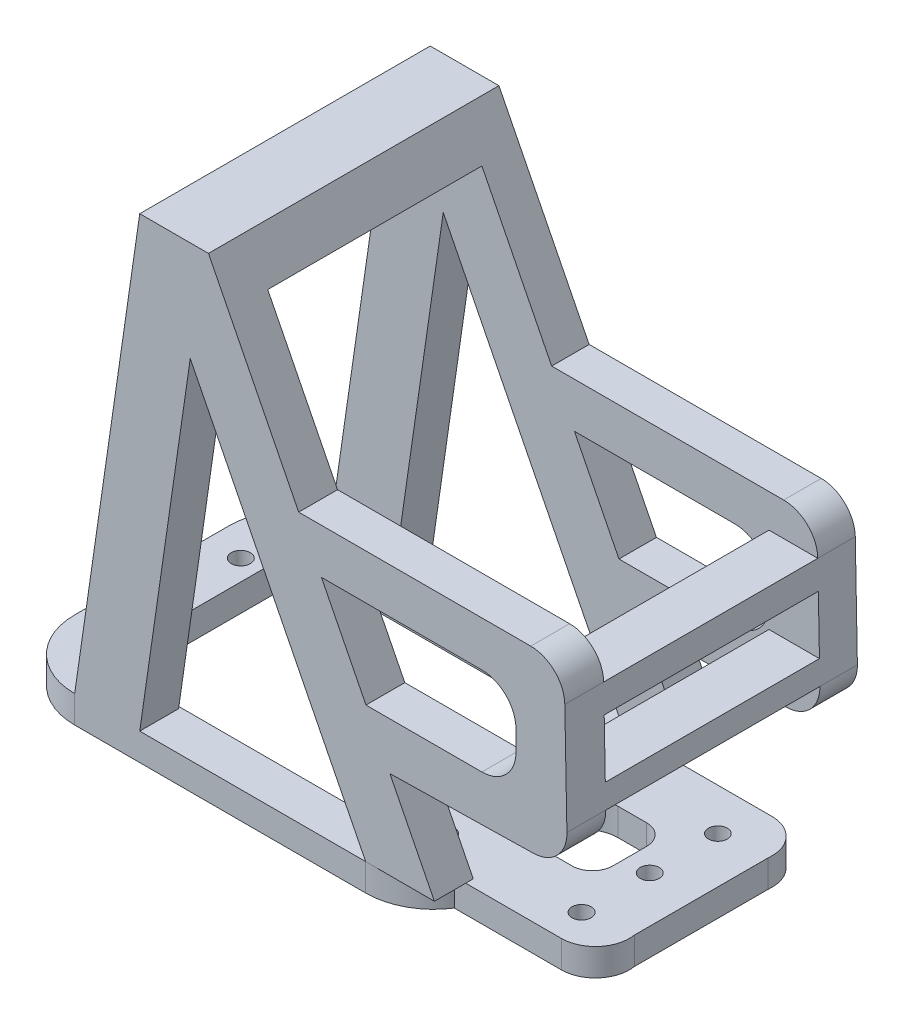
SolidWorks part; units mm, degrees
ref_plane "前视基准面" through (0, 0, 0) normal (0, 0, 1) x (1, 0, 0)
ref_plane "上视基准面" through (0, 0, 0) normal (0, 1, 0) x (1, 0, 0)
ref_plane "右视基准面" through (0, 0, 0) normal (1, 0, 0) x (0, 0, -1)
sketch "草图1" plane through (0, 0, 0) normal (0, 1, 0) x (1, 0, 0)
  line L0 (61.0864, -14.9277) -> (61.0864, -17.1775) construction
  line L1 (-10.3707, 21.899) -> (31.6683, 21.899)
  line L2 (-20.3707, 11.899) -> (-20.3707, -10.7205)
  line L3 (-10.3707, -20.7205) -> (32.3279, -20.7205)
  line L5 (41.2303, 14.8263) -> (56.4092, 14.8263)
  line L7 (40.7399, -16.1276) -> (56.4399, -16.1276)
  line L10 (-7.3707, 15.899) -> (23.8662, 15.899)
  line L11 (-12.3707, 10.899) -> (-12.3707, -9.7205)
  line L12 (-7.3707, -14.7205) -> (23.8662, -14.7205)
  line L14 (43.8001, 4.8263) -> (48.008, 4.8263)
  line L16 (43.828, -6.1276) -> (48.008, -6.1276)
  line L17 (51.008, 1.8263) -> (51.008, -3.1276)
  line L21 (61.3782, 9.2709) -> (61.3782, -10.3446)
  line L22 (28.8662, -9.7205) -> (28.8662, 10.899)
  line L24 (38.8022, -0.3196) -> (38.8301, -1.2735)
  arc A0 (-20.3707, -10.7205) -> (-10.3707, -20.7205) centre (-10.3707, -10.7205) ccw
  arc A1 (-10.3707, 21.899) -> (-20.3707, 11.899) centre (-10.3707, 11.899) ccw
  arc A2 (32.3279, -20.7205) -> (40.7399, -16.1276) centre (32.3279, -10.7205) ccw
  arc A3 (31.6683, 21.899) -> (41.2303, 14.8263) centre (31.6683, 11.899) cw
  arc A4 (61.3782, -10.3446) -> (56.4399, -16.1276) centre (56.4399, -11.1276) cw
  arc A5 (61.3782, 9.2709) -> (56.4092, 14.8263) centre (56.4092, 9.8263) ccw
  arc A6 (52.508, -7.6275) -> (49.5081, -7.6275) centre (51.008, -7.6275) ccw construction
  arc A9 (-7.3707, -14.7205) -> (-12.3707, -9.7205) centre (-7.3707, -9.7205) cw
  arc A10 (-7.3707, 15.899) -> (-12.3707, 10.899) centre (-7.3707, 10.899) ccw
  arc A13 (51.008, -3.1276) -> (48.008, -6.1276) centre (48.008, -3.1276) cw
  arc A14 (51.008, 1.8263) -> (48.008, 4.8263) centre (48.008, 1.8263) ccw
  circle A15 centre (-15.392, 8.6725) radius 1.4
  circle A16 centre (-15.392, -1.3275) radius 1.3979
  circle A17 centre (-15.392, -11.3275) radius 1.3827
  circle A18 centre (34.608, 8.6725) radius 1.3886
  circle A19 centre (34.608, -11.3275) radius 1.3911
  circle A20 centre (54.608, 8.6725) radius 1.388
  circle A21 centre (54.608, -1.3275) radius 1.397
  circle A22 centre (54.608, -11.3275) radius 1.4035
  arc A23 (38.8301, -1.2735) -> (43.828, -6.1276) centre (43.828, -1.1276) ccw
  arc A24 (38.8022, -0.3196) -> (43.8001, 4.8263) centre (43.8001, -0.1737) cw
  arc A25 (28.8662, -9.7205) -> (23.8662, -14.7205) centre (23.8662, -9.7205) cw
  arc A26 (28.8662, 10.899) -> (23.8662, 15.899) centre (23.8662, 10.899) ccw
  point P6 (28.5114, 15.899)
  point P21 (61.0864, -15.3365)
  point P46 (51.008, -6.1276)
  dimension "D1" = 10
  dimension "D2" = 5
  dimension "D3" = 10
  dimension "D4" = 5
  dimension "D5" = 10
  dimension "D6" = 3
  dimension "D7" = 2.8
  dimension "D11" = 5
  dimension "D8" = 6
  dimension "D9" = 6
  dimension "D10" = 8
extrude "凸台-拉伸1" add sketch "草图1" along normal blind 4
sketch "草图5" plane through (0, 0, 20.7205) normal (0, 0, 1) x (1, 0, 0)
  line L0 (-10.3707, 4) -> (-0.8249, 69.7495)
  line L3 (-10.3707, 4) -> (32.3279, 4) construction
  line L4 (-0.8249, 4) -> (-10.3707, 4)
  line L5 (32.3279, 4) -> (-0.8249, 69.7495)
  line L6 (-0.8249, 69.7495) -> (9.2578, 69.7495)
  line L7 (9.2578, 69.7495) -> (42.4106, 4)
  line L8 (40.7399, 4) -> (56.4399, 4) construction
  line L9 (42.4106, 4) -> (32.3279, 4)
  line L10 (22.4989, 43.4893) -> (56.5462, 43.4893)
  line L11 (61.5453, 38.5847) -> (61.8529, 22.4558)
  line L12 (56.9492, 17.3614) -> (35.876, 16.9595)
  line L13 (25.8342, 36.8748) -> (49.3813, 36.8748)
  line L14 (54.3813, 31.8748) -> (54.3813, 28.9109)
  line L15 (49.3813, 23.9109) -> (32.3709, 23.9109)
  line L16 (-0.8249, 4) -> (6.5868, 55.0504)
  arc A0 (54.3813, 28.9109) -> (49.3813, 23.9109) centre (49.3813, 28.9109) cw
  arc A1 (54.3813, 31.8748) -> (49.3813, 36.8748) centre (49.3813, 31.8748) ccw
  arc A2 (61.8529, 22.4558) -> (56.9492, 17.3614) centre (56.8538, 22.3605) cw
  arc A3 (56.5462, 43.4893) -> (61.5453, 38.5847) centre (56.5462, 38.4893) cw
  spline S0 degree 3 poles (82.3635, 34.1138) (82.1108, 34.227) (81.7489, 34.3893) (81.1525, 34.6566) (80.4773, 34.9593) (79.7004, 35.3076) (78.6378, 35.784) (77.507, 36.2909) (75.9609, 36.9841) (74.8944, 37.4622) (74.111, 37.8135) (73.8509, 37.9301) (73.6209, 38.0332) (73.3899, 38.1367) (73.2086, 38.218) (72.967, 38.3263) (72.7294, 38.4329) (72.375, 38.5918) (71.8857, 38.8112) (71.3179, 39.0657) (70.476, 39.4432) (69.6786, 39.8007) (68.8034, 40.1931) (68.3054, 40.4163) (67.8294, 40.6297) (67.4241, 40.8115) (66.9507, 41.0237) (66.3775, 41.2807) (65.8152, 41.5329) (65.1974, 41.8099) (64.5957, 42.0796) (64.02, 42.3378) (63.4354, 42.5999) (63.0021, 42.7942) (62.5979, 42.9754) (62.2232, 43.1434) (61.7973, 43.3344) (61.4045, 43.5105) (61.0077, 43.6885) (60.665, 43.8421) (60.3546, 43.9813) (60.1352, 44.0797) (59.8921, 44.1887) (59.5959, 44.3215) (59.2631, 44.4707) (58.9915, 44.5925) (58.8406, 44.6602) (58.8096, 44.6741) knots 0 0 0 0 0.032193 0.04611 0.075984 0.118223 0.145085 0.21136 0.262286 0.342049 0.347223 0.362088 0.375183 0.37653 0.391497 0.398287 0.4073 0.421757 0.443444 0.469626 0.494074 0.550684 0.571193 0.605541 0.614113 0.631817 0.657156 0.674406 0.704819 0.728769 0.753084 0.781436 0.802085 0.827522 0.836612 0.853553 0.875226 0.890849 0.903564 0.92575 0.93448 0.943081 0.953685 0.965424 0.98079 0.996052 1 1 1 1 construction
  point P31 (61.4517, 43.4893)
  dimension "D1" = 5
extrude "凸台-拉伸2" add sketch "草图5" against normal blind 5.7
sketch "草图6" plane through (0, 0, -21.899) normal (0, 0, -1) x (-1, 0, 0)
  line L0 (10.3707, 4) -> (0.8249, 69.7495)
  line L2 (0.8249, 4) -> (-6.5868, 55.0504)
  line L3 (-6.5868, 55.0504) -> (-32.3279, 4)
  line L4 (-32.3279, 4) -> (-42.4106, 4)
  line L5 (-42.4106, 4) -> (-9.2578, 69.7495)
  line L6 (-9.2578, 69.7495) -> (0.8249, 69.7495)
  line L7 (-22.4989, 43.4893) -> (-56.5462, 43.4893)
  line L8 (-61.5453, 38.5847) -> (-61.8529, 22.4558)
  line L9 (-56.9492, 17.3614) -> (-35.876, 16.9595)
  line L10 (-35.876, 16.9595) -> (-32.3709, 23.9109)
  line L11 (-32.3709, 23.9109) -> (-49.3813, 23.9109)
  line L12 (-54.3813, 28.9109) -> (-54.3813, 31.8748)
  line L13 (-49.3813, 36.8748) -> (-25.8342, 36.8748)
  line L14 (-25.8342, 36.8748) -> (-22.4989, 43.4893)
  line L15 (0.8249, 4) -> (10.3707, 4)
  arc A0 (-49.3813, 23.9109) -> (-54.3813, 28.9109) centre (-49.3813, 28.9109) cw
  arc A1 (-49.3813, 36.8748) -> (-54.3813, 31.8748) centre (-49.3813, 31.8748) ccw
  arc A2 (-56.9492, 17.3614) -> (-61.8529, 22.4558) centre (-56.8538, 22.3605) cw
  arc A3 (-56.5462, 43.4893) -> (-61.5453, 38.5847) centre (-56.5462, 38.4893) ccw
  point P32 (-54.3813, 23.9109)
  point P35 (-54.3813, 36.8748)
  point P38 (-61.9483, 17.4568)
  point P41 (-61.4517, 43.4893)
  dimension "D1" = 5
extrude "凸台-拉伸4" add sketch "草图6" against normal blind 5.5 contours L6 L5 L4 L3 L2 L0 M23 | L7 A3 L8 A2 L9 L5 L11 A0 L12 A1 L13
sketch "草图7" plane through (0, 0, -16.399) normal (0, 0, 1) x (1, 0, 0)
  line L0 (-0.8249, 69.7495) -> (9.2578, 69.7495)
  line L1 (9.2578, 69.7495) -> (12.2568, 63.8017)
  line L2 (9.2578, 69.7495) -> (22.4989, 43.4893) construction
  line L3 (12.2568, 63.8017) -> (-1.6884, 63.8017)
  line L4 (-10.3707, 4) -> (-0.8249, 69.7495) construction
  line L5 (-1.6884, 63.8017) -> (-0.8249, 69.7495)
  line L6 (61.5453, 38.5847) -> (54.3813, 38.5847)
  line L7 (54.3813, 38.5847) -> (54.3813, 34.4335)
  line L8 (54.3813, 34.4335) -> (61.6245, 34.4335)
  line L9 (61.5453, 38.5847) -> (61.8529, 22.4558) construction
  line L10 (61.6245, 34.4335) -> (61.5453, 38.5847)
  line L11 (61.8529, 22.4558) -> (54.3813, 22.4558)
  line L12 (54.3813, 22.4558) -> (54.3813, 25.961)
  line L13 (54.3813, 25.961) -> (61.7861, 25.961)
  line L14 (61.7861, 25.961) -> (61.8529, 22.4558)
extrude "凸台-拉伸5" add sketch "草图7" along normal blind 34.5
